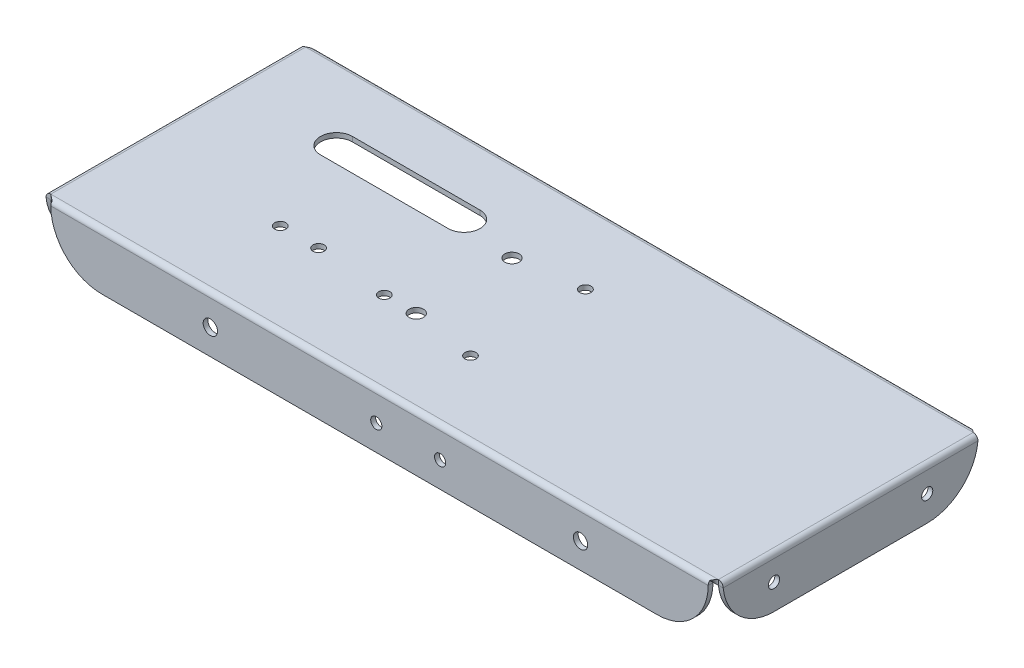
SolidWorks part; units mm, degrees
ref_plane "Front Plane" through (0, 0, 0) normal (0, 0, 1) x (1, 0, 0)
ref_plane "Top Plane" through (0, 0, 0) normal (0, 1, 0) x (1, 0, 0)
ref_plane "Right Plane" through (0, 0, 0) normal (1, 0, 0) x (0, 0, -1)
sketch "Sketch1" plane through (0, 0, 0) normal (0, 1, 0) x (1, 0, 0)
  line L0 (103, 80) -> (103, 0) construction
  line L1 (0, 0) -> (206, 0) construction
  line L2 (0, 0) -> (0, 80) construction
  line L3 (0, 80) -> (206, 80) construction
  line L4 (206, 0) -> (206, 80) construction
  line L5 (206, 40) -> (0, 40) construction
  line L6 (16, 80) -> (16, 96) construction
  line L7 (0, 64) -> (-16, 64) construction
  line L8 (190, 80) -> (190, 96) construction
  line L9 (206, 64) -> (222, 64) construction
  line L10 (16, 96) -> (190, 96)
  line L11 (16, 88) -> (190, 88) construction
  line L12 (-8, 64) -> (-8, 40) construction
  line L13 (16, -16) -> (190, -16)
  line L14 (-16, 64) -> (-16, 16)
  line L15 (222, 64) -> (222, 16)
  line L16 (30, 63) -> (70, 63)
  line L17 (70, 53) -> (30, 53)
  line L18 (43, 27.4) -> (55, 27.4) construction
  line L19 (108, 22) -> (108, 58) construction
  line L20 (88, 25) -> (88, 55) construction
  line L21 (88, 25) -> (78, 25) construction
  arc A0 (190, 96) -> (206, 80) centre (190, 80) cw
  arc A1 (206, 80) -> (222, 64) centre (206, 64) cw
  circle A2 centre (50, 88) radius 2.25
  circle A3 centre (102, 88) radius 1.75
  circle A4 centre (122, 88) radius 1.75
  circle A5 centre (166, 88) radius 2.25
  arc A6 (0, 80) -> (-16, 64) centre (0, 64) ccw
  arc A7 (16, 96) -> (0, 80) centre (16, 80) ccw
  circle A8 centre (-8, 64) radius 1.75
  circle A9 centre (214, 64) radius 1.75
  circle A10 centre (-8, 16) radius 1.75
  arc A11 (0, 0) -> (-16, 16) centre (0, 16) cw
  arc A12 (16, -16) -> (0, 0) centre (16, 0) cw
  circle A13 centre (50, -8) radius 2.25
  circle A14 centre (102, -8) radius 1.75
  circle A15 centre (122, -8) radius 1.75
  circle A16 centre (166, -8) radius 2.25
  arc A17 (190, -16) -> (206, 0) centre (190, 0) ccw
  arc A18 (206, 0) -> (222, 16) centre (206, 16) ccw
  circle A19 centre (214, 16) radius 1.75
  arc A20 (30, 63) -> (30, 53) centre (30, 58) ccw
  arc A21 (70, 53) -> (70, 63) centre (70, 58) ccw
  circle A22 centre (43, 27.4) radius 1.75
  circle A23 centre (55, 27.4) radius 1.75
  circle A24 centre (108, 58) radius 1.75
  circle A25 centre (108, 22) radius 1.75
  circle A26 centre (78, 25) radius 1.75
  circle A27 centre (88, 25) radius 2.25
  circle A28 centre (88, 55) radius 2.25
  dimension "D3" = 32
  dimension "D6" = 4.5
  dimension "D7" = 3.5
  dimension "D9" = 52
  dimension "D10" = 20
  dimension "D11" = 44
  dimension "D12" = 3.5
  dimension "D14" = 5
  dimension "D18" = 3.5
  dimension "D19" = 12
  dimension "D20" = 13
  dimension "D22" = 3.5
  dimension "D23" = 4.5
  dimension "D27" = 15
  dimension "D29" = 20
  dimension "D30" = 10
  dimension "D1" = 16
  dimension "D2" = 16
  dimension "D4" = 80
  dimension "D5" = 206
  dimension "D8" = 50
  dimension "D13" = 24
  dimension "D15" = 40
  dimension "D16" = 30
  dimension "D17" = 18
  dimension "D21" = 30.6
  dimension "D24" = 14
  dimension "D25" = 22
  dimension "D26" = 18
  dimension "D28" = 15
sheet metal parameters "Sheet-Metal1" thickness 1.5 parameters "D1"=1
base flange "Base-Flange1" sketch "Sketch1" thickness 1.5 reverse thickness direction no parameters "D1"=1
sketch "Sketch3" plane through (0, 0, 0) normal (0, 1, 0) x (1, 0, 0)
  line L0 (0, 80) -> (206, 80)
  line L2 (206, 0) -> (0, 0)
sketched bend "Sketched Bend1" parameters "D1"=0.1
bend "SketchBend1" bend radius 0.1 bend angle 90 parameters "D5"=1
bend "SketchBend2" bend radius 0.1 bend angle 90 parameters "D5"=2
sketch "Sketch4" plane through (0, 0, 0) normal (0, 1, 0) x (1, 0, 0)
  line L2 (-1.5835, 79.9214) -> (-1.5835, 0.0786)
  line L3 (207.5835, 79.9214) -> (207.5835, 0.0786)
sketched bend "Sketched Bend7" parameters "D1"=0.01
bend "SketchBend10" bend radius 0.01 bend angle 90 parameters "D5"=4
bend "SketchBend11" bend radius 0.01 bend angle 90 parameters "D5"=6
flat pattern "Flat-Pattern1"
sketch "Bend-Lines1" plane through (0, 0, 0) normal (0, 1, 0) x (-1, 0, 0)
bend of the flat pattern "Flatten-<SketchBend1>1"
bend of the flat pattern "Flatten-<SketchBend2>1"
bend of the flat pattern "Flatten-<SketchBend10>1"
bend of the flat pattern "Flatten-<SketchBend11>1"
